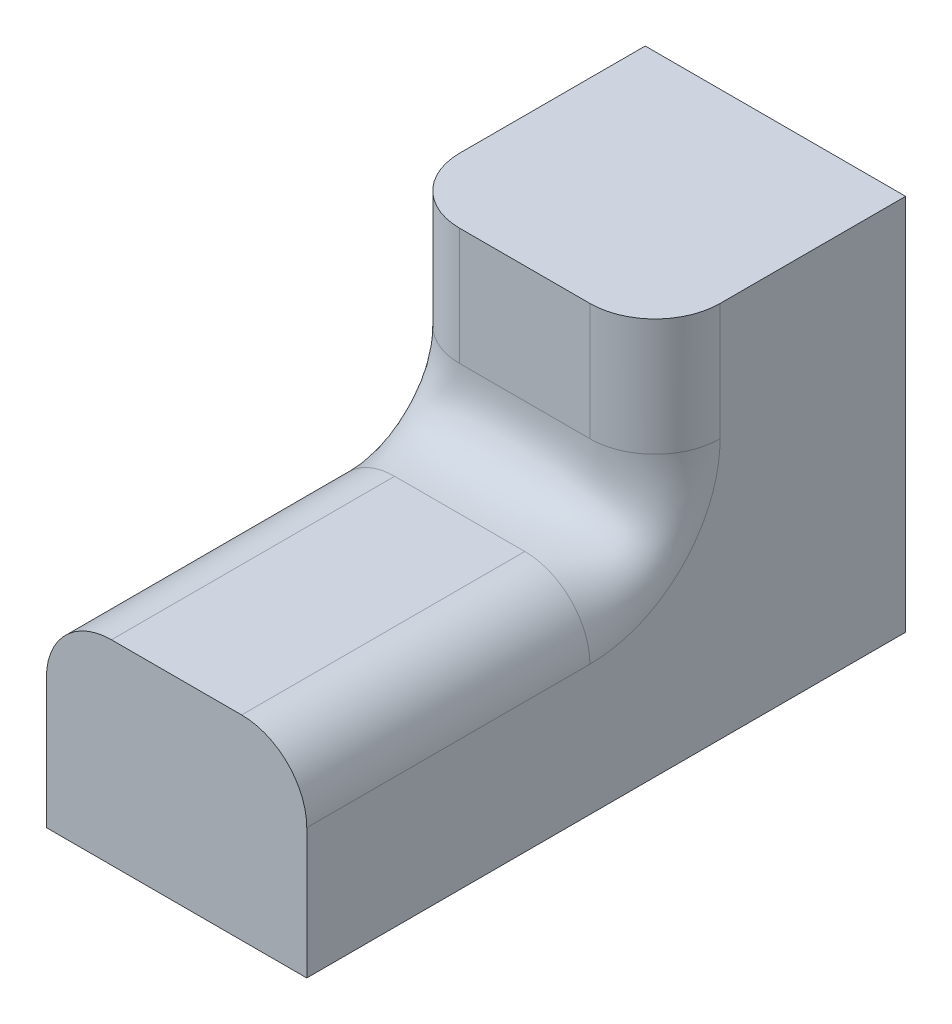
SolidWorks part; units mm, degrees
ref_plane "Front" through (0, 0, 0) normal (0, 0, 1) x (1, 0, 0)
ref_plane "Top" through (0, 0, 0) normal (0, 1, 0) x (1, 0, 0)
ref_plane "Right" through (0, 0, 0) normal (1, 0, 0) x (0, 0, -1)
sketch "Sketch1" plane through (0, 0, 0) normal (1, 0, 0) x (0, 0, -1)
  line L0 (0, 0) -> (-92, 0)
  line L1 (-92, 0) -> (-92, 30)
  line L2 (-92, 30) -> (-38.5, 30)
  line L3 (-38.5, 30) -> (-38.5, 58)
  line L4 (-38.5, 58) -> (0, 58)
  line L5 (0, 58) -> (0, 0)
  dimension "D1" = 92
  dimension "D2" = 58
  dimension "D3" = 30
  dimension "D4" = 38.5
extrude "Boss-Extrude1" add sketch "Sketch1" along normal mid plane 40
fillet "Fillet1" radius 10 5 edges at (20, 30, 65.25) (20, 44, 38.5) (0, 30, 38.5) (-20, 44, 38.5) (-20, 30, 65.25)
other "DeleteFace3"
